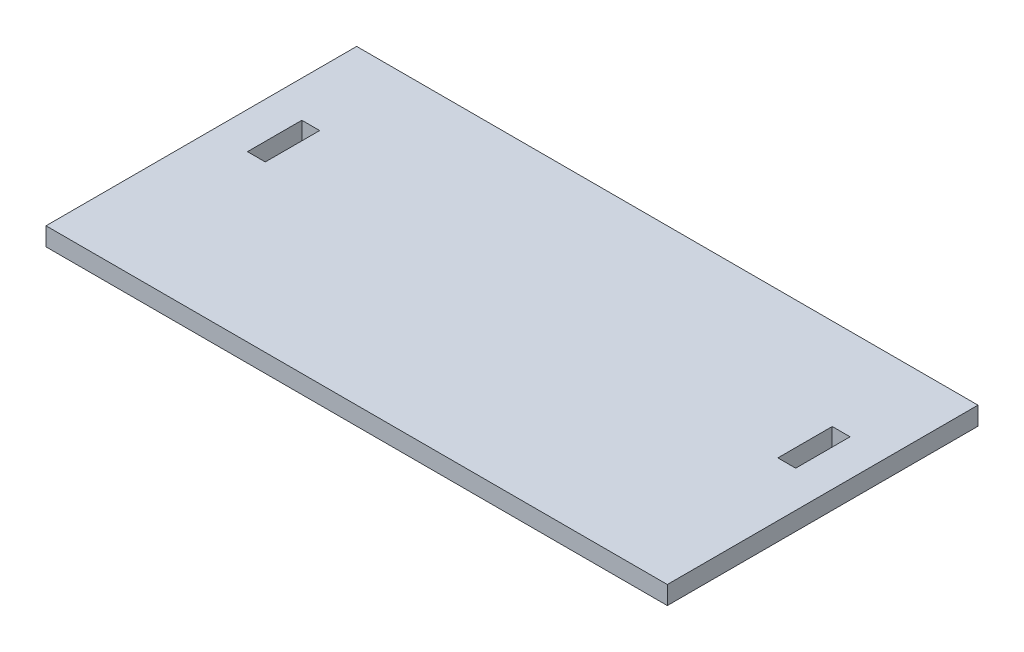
SolidWorks part; units mm, degrees
ref_plane "Front Plane" through (0, 0, 0) normal (0, 0, 1) x (1, 0, 0)
ref_plane "Top Plane" through (0, 0, 0) normal (0, 1, 0) x (1, 0, 0)
ref_plane "Right Plane" through (0, 0, 0) normal (1, 0, 0) x (0, 0, -1)
sketch "Sketch1" plane through (0, 0, 0) normal (0, 1, 0) x (1, 0, 0)
  line L0 (101.2384, 58.2175) -> (101.2384, -111.7825) construction
  line L1 (-68.7616, 58.2175) -> (271.2384, 58.2175)
  line L2 (-68.7616, 58.2175) -> (-68.7616, -111.7825)
  line L3 (-68.7616, -111.7825) -> (271.2384, -111.7825)
  line L4 (271.2384, 58.2175) -> (271.2384, -111.7825)
  line L5 (-48.7616, 8.2175) -> (-39.0016, 8.2175)
  line L6 (-48.7616, 8.2175) -> (-48.7616, -21.5425)
  line L7 (-48.7616, -21.5425) -> (-39.0016, -21.5425)
  line L8 (-39.0016, 8.2175) -> (-39.0016, -21.5425)
  line L9 (251.2384, -21.5425) -> (241.4784, -21.5425)
  line L10 (241.4784, 8.2175) -> (241.4784, -21.5425)
  line L11 (251.2384, 8.2175) -> (251.2384, -21.5425)
  line L12 (251.2384, 8.2175) -> (241.4784, 8.2175)
extrude "Boss-Extrude1" add sketch "Sketch1" along normal blind 10
equation "\"HeightHouse\" = \"SCALE\"*200mm"
equation "\"LenghtHouse\"=\"SCALE\"* 300mm"
equation "\"WidthHouse\"= \"SCALE\"*230mm"
equation "\"ThicknessMaterial\"=10mm"
equation "\"Kerf\"= 0.12mm"
equation "\"WidthWindows\"=\"SCALE\"* 45mm"
equation "\"WidthDoor\"=\"SCALE\"* 60mm"
equation "\"HeightDoor\"=\"SCALE\"* 80mm"
equation "\"LenghtJoints\" =\"SCALE\"* 30mm"
equation "\"HeightWindows\"=\"SCALE\"* 60"
equation "\"DistanceForJointsRoof\"=\"SCALE\"* 50mm"
equation "\"Roof1\"=\"SCALE\"* 115mm"
equation "\"Roof2\"=\"SCALE\"* 140mm"
equation "\"WidthWindowFrame\"=\"SCALE\"* 3mm"
equation "\"DistanceForJointsBody\"=\"SCALE\"* 35mm"
equation "\"CornerRoofBig\"=70deg"
equation "\"CornerRoofSmall\"= 60deg"
equation "\"D1@Sketch1\"=\"LenghtRoof\""
equation "\"D4@Sketch1\"=(\"LenghtRoof\"-\"LenghtHouse\")/2"
equation "\"LenghtRoof\"= \"LenghtHouse\"+(\"SCALE\"*40mm)"
equation "\"RoofSmall\"=\"SCALE\"* 120mm"
equation "\"RoofBig\"=\"SCALE\"* 170mm"
equation "\"D2@Sketch1\"=\"RoofBig\""
equation "\"D1@Boss-Extrude1\"=\"ThicknessMaterial\""
equation "\"D5@Sketch1\"=\"LenghtJoints\"-\"Kerf\"*2"
equation "\"D6@Sketch1\"=\"ThicknessMaterial\"-\"Kerf\"*2"
equation "\"D3@Sketch1\"=\"DistanceForJointsRoof\""
